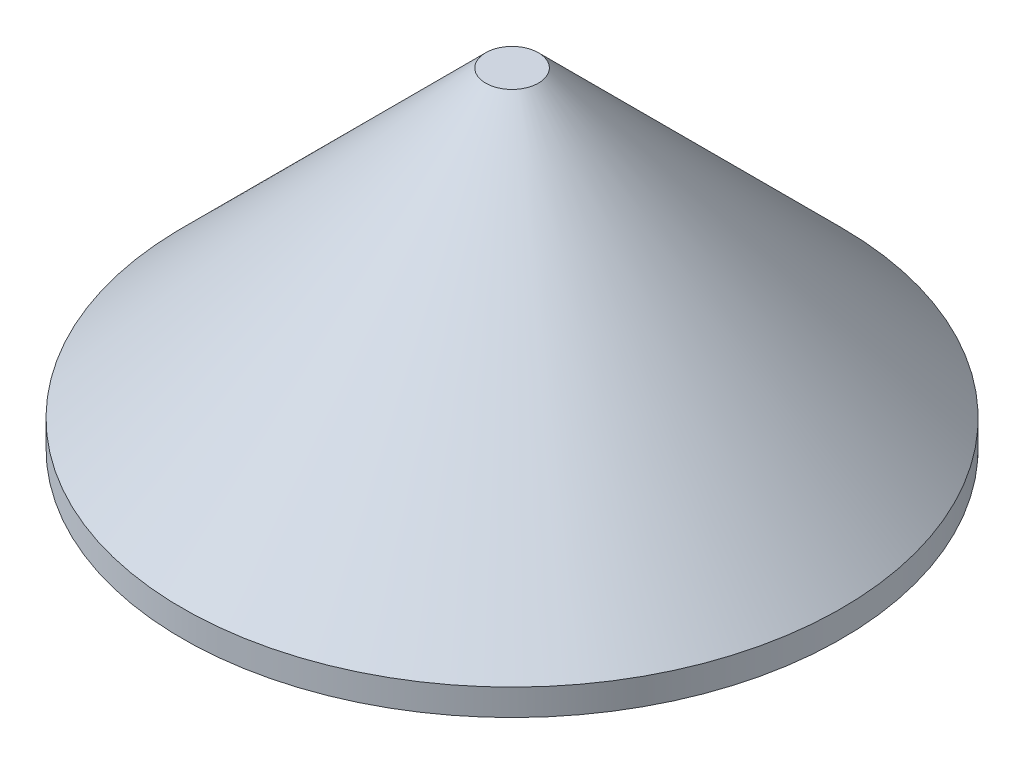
SolidWorks part; units mm, degrees
ref_plane "Ebene vorne" through (0, 0, 0) normal (0, 0, 1) x (1, 0, 0)
ref_plane "Ebene oben" through (0, 0, 0) normal (0, 1, 0) x (1, 0, 0)
ref_plane "Ebene rechts" through (0, 0, 0) normal (1, 0, 0) x (0, 0, -1)
sketch "Skizze1" plane through (0, 0, 0) normal (0, 0, 1) x (1, 0, 0)
  line L0 (0, 0) -> (0, 43.1002) construction
  line L1 (0, 0) -> (25, 0)
  line L2 (25, 0) -> (25, 2)
  line L3 (25, 2) -> (2, 25)
  line L4 (2, 25) -> (0, 25)
  line L5 (0, 25) -> (0, 0)
  dimension "D1" = 45
  dimension "D2" = 25
  dimension "D3" = 25
  dimension "D4" = 2
revolve "Rotation1" add sketch "Skizze1" angle 360 about L0
